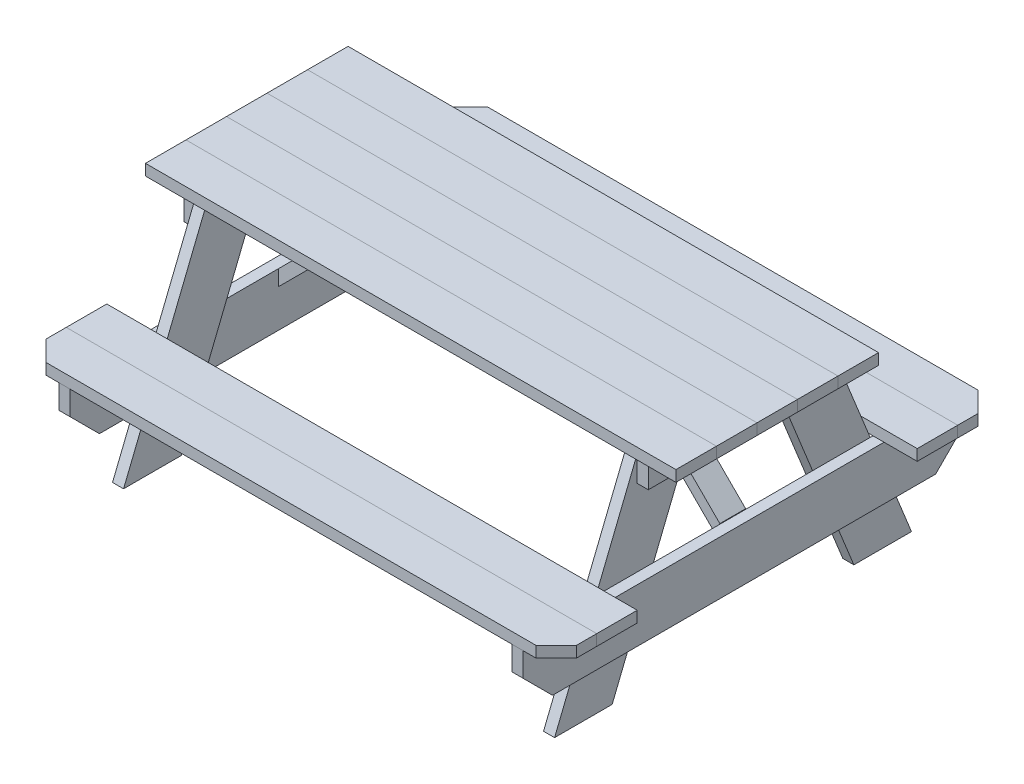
SolidWorks part; units mm, degrees
ref_plane "Front Plane" through (0, 0, 0) normal (0, 0, 1) x (1, 0, 0)
ref_plane "Top Plane" through (0, 0, 0) normal (0, 1, 0) x (1, 0, 0)
ref_plane "Right Plane" through (0, 0, 0) normal (1, 0, 0) x (0, 0, -1)
ref_plane "A-Frame Plane" through (-762, 0, 0) normal (1, 0, 0) x (0, 0, -1)
sketch "A-Frame Layout" plane through (-762, 0, 0) normal (1, 0, 0) x (0, 0, -1)
  line L0 (0, 0) -> (0, 706.5141) construction
  line L1 (330.2, 706.5141) -> (-330.2, 706.5141)
  line L2 (-330.2, 706.5141) -> (-615.6502, 0)
  line L3 (-762, 353.257) -> (762, 353.257)
  line L4 (330.2, 706.5141) -> (615.6502, 0)
  line L5 (-615.6502, 0) -> (0, 0) construction
  point P8 (0, 353.257)
  point P10 (-472.9251, 353.257)
  dimension "D1" = 762
  dimension "D2" = 660.4
  dimension "D3" = 68
  dimension "D4" = 1524
sketch "Top and Brace Layout" plane through (0, 0, 0) normal (0, 0, 1) x (1, 0, 0)
  line L0 (0, 0) -> (0, 706.5141) construction
  line L1 (-914.4, 706.5141) -> (914.4, 706.5141)
  line L3 (-762, 353.257) -> (-408.743, 706.5141)
  line L4 (-762, 0) -> (-762, 706.5141) construction
  dimension "D1" = 1828.8
  dimension "D2" = 45
other "Softwood - configured 2 X 8(1)"
ref_plane "Plane1" through (-762, 706.5141, 330.2) normal (0, -0.9272, 0.3746) x (0, -0.3746, -0.9272)
sketch "Sketch1" plane through (-762, 706.5141, 330.2) normal (0, -0.9272, 0.3746) x (0, -0.3746, -0.9272)
  line L1 (-92.075, -19.05) -> (92.075, -19.05)
  line L2 (-92.075, -19.05) -> (-92.075, 19.05)
  line L3 (-92.075, 19.05) -> (92.075, 19.05)
  line L4 (92.075, -19.05) -> (92.075, 19.05)
  line L5 (0, 19.05) -> (0, -19.05) construction
  line L6 (-92.075, 0) -> (92.075, 0) construction
  point P0 (0, 0)
  point P4 (0, 0)
  dimension "Thickness" = 38.1
  dimension "Width" = 184.15
other "Softwood - configured 2 X 4(1)"
ref_plane "Plane2" through (-762, 706.5141, -330.2) normal (0, 0, 1) x (-0.7071, -0.7071, 0)
sketch "Sketch11" plane through (-762, 706.5141, -330.2) normal (0, 0, 1) x (-0.7071, -0.7071, 0)
  line L1 (-44.45, -19.05) -> (44.45, -19.05)
  line L2 (-44.45, -19.05) -> (-44.45, 19.05)
  line L3 (-44.45, 19.05) -> (44.45, 19.05)
  line L4 (44.45, -19.05) -> (44.45, 19.05)
  line L5 (0, 19.05) -> (0, -19.05) construction
  line L6 (-44.45, 0) -> (44.45, 0) construction
  point P0 (0, 0)
  point P4 (0, 0)
  dimension "Thickness" = 38.1
  dimension "Width" = 88.9
other "Softwood - configured 2 X 6(1)"
ref_plane "Plane3" through (-914.4, 725.5641, 0) normal (1, 0, 0) x (0, 0, 1)
sketch "Sketch13" plane through (-914.4, 725.5641, 0) normal (1, 0, 0) x (0, 0, 1)
  line L1 (-69.85, -19.05) -> (69.85, -19.05)
  line L2 (-69.85, -19.05) -> (-69.85, 19.05)
  line L3 (-69.85, 19.05) -> (69.85, 19.05)
  line L4 (69.85, -19.05) -> (69.85, 19.05)
  line L5 (0, 19.05) -> (0, -19.05) construction
  line L6 (-69.85, 0) -> (69.85, 0) construction
  point P0 (0, 0)
  point P4 (0, 0)
  dimension "Thickness" = 38.1
  dimension "Width" = 139.7
other "Trim/Extend1"
other "Trim/Extend2"
chamfer "Chamfer1" distance 101.6 angle 45 2 edges at (-781.05, 169.107, -762) (-781.05, 169.107, 762)
mirror "Mirror1" about plane through (0, 0, 0) normal (1, 0, 0)
pattern_linear "LPattern1" count 3 spacing 139.7 along (0, 0, -1) count 3 spacing 139.7 along (0, 0, 1)
sketch "Bench Sketch" plane through (0, 353.257, 0) normal (0, 1, 0) x (1, 0, 0)
  line L0 (-914.4, -762) -> (914.4, -762)
  line L1 (0, 0) -> (0, -762) construction
  line L2 (-800.1, -762) -> (-762, -762) construction
  dimension "D1" = 1828.8
other "Softwood - configured 2 X 6(2)"
ref_plane "Plane4" through (-914.4, 372.307, 692.15) normal (1, 0, 0) x (0, 0, -1)
sketch "Sketch14" plane through (-914.4, 372.307, 692.15) normal (1, 0, 0) x (0, 0, -1)
  line L1 (-69.85, -19.05) -> (69.85, -19.05)
  line L2 (-69.85, -19.05) -> (-69.85, 19.05)
  line L3 (-69.85, 19.05) -> (69.85, 19.05)
  line L4 (69.85, -19.05) -> (69.85, 19.05)
  line L5 (0, 19.05) -> (0, -19.05) construction
  line L6 (-69.85, 0) -> (69.85, 0) construction
  point P0 (0, 0)
  point P4 (0, 0)
  dimension "Thickness" = 38.1
  dimension "Width" = 139.7
pattern_linear "LPattern2" count 2 spacing 139.7 along (0, 0, -1)
chamfer "Chamfer2" distance 69.85 angle 45 2 edges at (-914.4, 372.307, 762) (914.4, 372.307, 762)
mirror "Mirror2" about plane through (0, 0, 0) normal (0, 0, 1)
